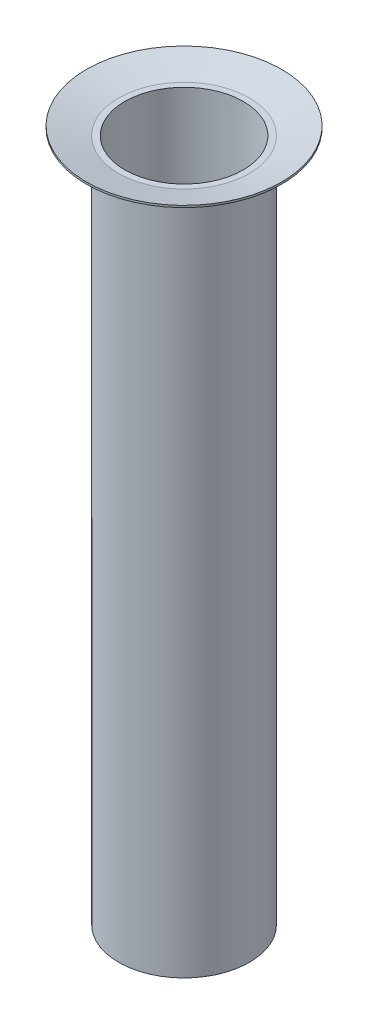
SolidWorks part; units mm, degrees
ref_plane "Front Plane" through (0, 0, 0) normal (0, 0, 1) x (1, 0, 0)
ref_plane "Top Plane" through (0, 0, 0) normal (0, 1, 0) x (1, 0, 0)
ref_plane "Right Plane" through (0, 0, 0) normal (1, 0, 0) x (0, 0, -1)
sketch "Sketch1" plane through (0, 0, 0) normal (0, 0, 1) x (1, 0, 0)
  line L0 (0, 0) -> (8.509, 0)
  line L1 (8.509, 0) -> (8.509, 88.646)
  line L2 (8.509, 88.646) -> (12.7, 89.769)
  line L3 (12.7, 89.769) -> (12.7, 90.023)
  line L5 (0, 88.9) -> (0, 0)
  line L6 (0, 93.0279) -> (0, 0) construction
  line L7 (12.7, 90.023) -> (8.509, 88.9)
  line L9 (8.509, 88.9) -> (0, 88.9)
  dimension "D1" = 8.509
  dimension "D2" = 88.646
revolve "Revolve1" add sketch "Sketch1" angle 360 about L6
shell "Shell1" thickness 0.7937
